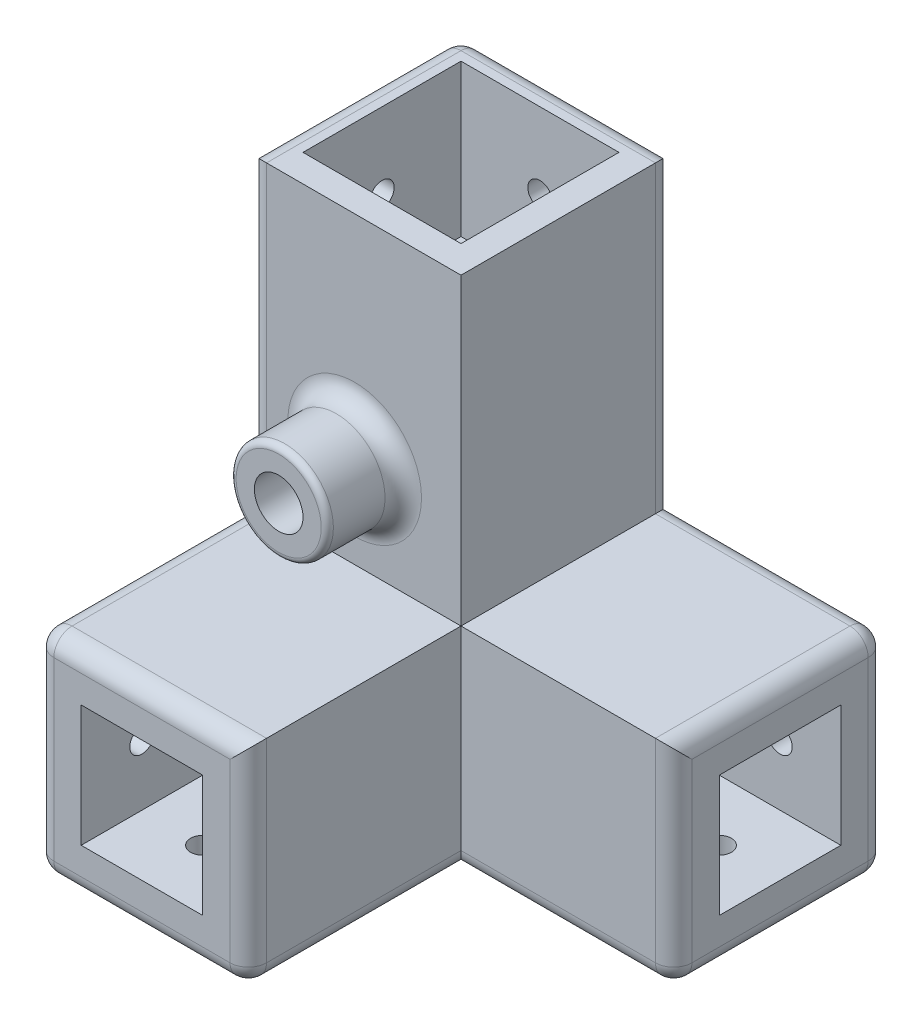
SolidWorks part; units mm, degrees
ref_plane "Alzado" through (0, 0, 0) normal (0, 0, 1) x (1, 0, 0)
ref_plane "Planta" through (0, 0, 0) normal (0, 1, 0) x (1, 0, 0)
ref_plane "Vista lateral" through (0, 0, 0) normal (1, 0, 0) x (0, 0, -1)
sketch "Sketch1" plane through (0, 0, 0) normal (0, 0, 1) x (1, 0, 0)
  line L0 (0, 85) -> (0, 0)
  line L1 (0, 0) -> (70, 0)
  line L2 (70, 0) -> (70, 35)
  line L3 (70, 35) -> (35, 35)
  line L4 (35, 35) -> (35, 85)
  line L5 (35, 85) -> (0, 85)
  dimension "D1" = 85
  dimension "D2" = 70
  dimension "D3" = 35
  dimension "D4" = 35
extrude "Boss-Extrude1" add sketch "Sketch1" along normal blind 35
sketch "Sketch4" plane through (70, 0, 0) normal (1, 0, 0) x (0, 0, -1)
  line L0 (0, 0) -> (0, 35) construction
  line L1 (-27.5, 27.5) -> (-7.5, 27.5)
  line L2 (-27.5, 27.5) -> (-27.5, 7.5)
  line L3 (-27.5, 7.5) -> (-7.5, 7.5)
  line L4 (-7.5, 27.5) -> (-7.5, 7.5)
  line L5 (-27.5, 27.5) -> (-7.5, 7.5) construction
  line L6 (-27.5, 7.5) -> (-7.5, 27.5) construction
  line L7 (-35, 0) -> (0, 0) construction
  point P0 (-17.5, 17.5)
  dimension "D1" = 20
  dimension "D2" = 20
  dimension "D3" = 17.5
  dimension "D4" = 17.5
sketch "Sketch5" plane through (0, 85, 0) normal (0, 1, 0) x (1, 0, 0)
  line L0 (35, 0) -> (0, 0) construction
  line L1 (4.5, -4.5) -> (30.5, -4.5)
  line L2 (4.5, -4.5) -> (4.5, -30.5)
  line L3 (4.5, -30.5) -> (30.5, -30.5)
  line L4 (30.5, -4.5) -> (30.5, -30.5)
  line L5 (4.5, -4.5) -> (30.5, -30.5) construction
  line L6 (4.5, -30.5) -> (30.5, -4.5) construction
  line L7 (35, -35) -> (35, 0) construction
  point P0 (17.5, -17.5)
  dimension "D1" = 26
  dimension "D2" = 26
  dimension "D3" = 17.5
  dimension "D4" = 17.5
sketch "Sketch8" plane through (0, 0, 35) normal (0, 0, 1) x (1, 0, 0)
  line L1 (0, 0) -> (35, 0)
  line L2 (0, 0) -> (0, 35)
  line L3 (0, 35) -> (35, 35)
  line L4 (35, 0) -> (35, 35)
extrude "Boss-Extrude2" add sketch "Sketch8" along normal blind 35
sketch "Sketch9" plane through (0, 0, 70) normal (0, 0, 1) x (1, 0, 0)
  line L0 (0, 35) -> (0, 0) construction
  line L1 (7.5, 27.5) -> (27.5, 27.5)
  line L2 (7.5, 27.5) -> (7.5, 7.5)
  line L3 (7.5, 7.5) -> (27.5, 7.5)
  line L4 (27.5, 27.5) -> (27.5, 7.5)
  line L5 (7.5, 27.5) -> (27.5, 7.5) construction
  line L6 (7.5, 7.5) -> (27.5, 27.5) construction
  line L8 (0, 0) -> (35, 0) construction
  point P0 (17.5, 17.5)
  dimension "D1" = 20
  dimension "D2" = 20
  dimension "D3" = 17.5
  dimension "D4" = 17.5
extrude "Cut-Extrude1" cut sketch "Sketch9" against normal blind 20
extrude "Cut-Extrude2" cut sketch "Sketch4" against normal blind 20
extrude "Cut-Extrude4" cut sketch "Sketch5" against normal blind 25
sketch "Sketch12" plane through (0, 0, 0) normal (-1, 0, 0) x (0, 0, 1)
  line L0 (0, 85) -> (0, 0) construction
  line L1 (35, 85) -> (0, 85) construction
  line L2 (70, 35) -> (70, 0) construction
  line L3 (70, 35) -> (35, 35) construction
  circle A0 centre (17.5, 72.5) radius 2
  circle A1 centre (60, 17.5) radius 2
  dimension "D1" = 4
  dimension "D2" = 4
  dimension "D3" = 17.5
  dimension "D4" = 12.5
  dimension "D5" = 10
  dimension "D6" = 17.5
extrude "Cut-Extrude5" cut sketch "Sketch12" against normal blind 10
sketch "Sketch13" plane through (0, 0, 0) normal (0, 0, -1) x (-1, 0, 0)
  line L0 (-70, 0) -> (-70, 35) construction
  line L1 (-35, 35) -> (-35, 85) construction
  line L2 (-35, 85) -> (0, 85) construction
  line L3 (-70, 35) -> (-35, 35) construction
  circle A0 centre (-17.5, 72.5) radius 2
  circle A1 centre (-60, 17.5) radius 2
  dimension "D1" = 4
  dimension "D2" = 4
  dimension "D3" = 10
  dimension "D4" = 17.5
  dimension "D5" = 12.5
  dimension "D6" = 17.5
extrude "Cut-Extrude6" cut sketch "Sketch13" against normal blind 10
sketch "Sketch14" plane through (0, 0, 0) normal (0, -1, 0) x (1, 0, 0)
  line L0 (0, 70) -> (35, 70) construction
  line L3 (70, 35) -> (70, 0) construction
  line L4 (0, 0) -> (70, 0) construction
  line L5 (35, 70) -> (35, 35) construction
  circle A0 centre (17.5, 60) radius 2
  circle A1 centre (60, 17.5) radius 2
  dimension "D5" = 4
  dimension "D6" = 4
  dimension "D1" = 10
  dimension "D2" = 10
  dimension "D3" = 17.5
  dimension "D4" = 17.5
extrude "Cut-Extrude7" cut sketch "Sketch14" against normal blind 10
fillet "Fillet1" radius 3 19 edges at (17.5, 85, 0) (17.5, 0, 70) (17.5, 35, 70) (35, 17.5, 70) (35, 0, 52.5) (52.5, 0, 35) (70, 17.5, 35) (70, 35, 17.5) (70, 0, 17.5) (35, 0, 0) (70, 17.5, 0) (52.5, 35, 0) (35, 60, 0) (0, 85, 17.5) (0, 42.5, 0) (0, 60, 35) (0, 35, 52.5) (0, 17.5, 70) (0, 0, 35)
sketch "Sketch15" plane through (0, 0, 35) normal (0, 0, 1) x (1, 0, 0)
  line L0 (35, 35) -> (35, 85) construction
  line L1 (35, 85) -> (3, 85) construction
  circle A0 centre (17.5, 50) radius 8
  dimension "D1" = 16
  dimension "D2" = 17.5
  dimension "D3" = 35
extrude "Boss-Extrude3" add sketch "Sketch15" along normal blind 12.5
sketch "Sketch16" plane through (0, 0, 47.5) normal (0, 0, 1) x (1, 0, 0)
  circle A0 centre (17.5, 50) radius 4
  dimension "D1" = 8
extrude "Cut-Extrude8" cut sketch "Sketch16" against normal blind 25
fillet "Fillet2" radius 3 1 edges at (25.5, 50, 35)
fillet "Fillet3" radius 1 1 edges at (25.5, 50, 47.5)
